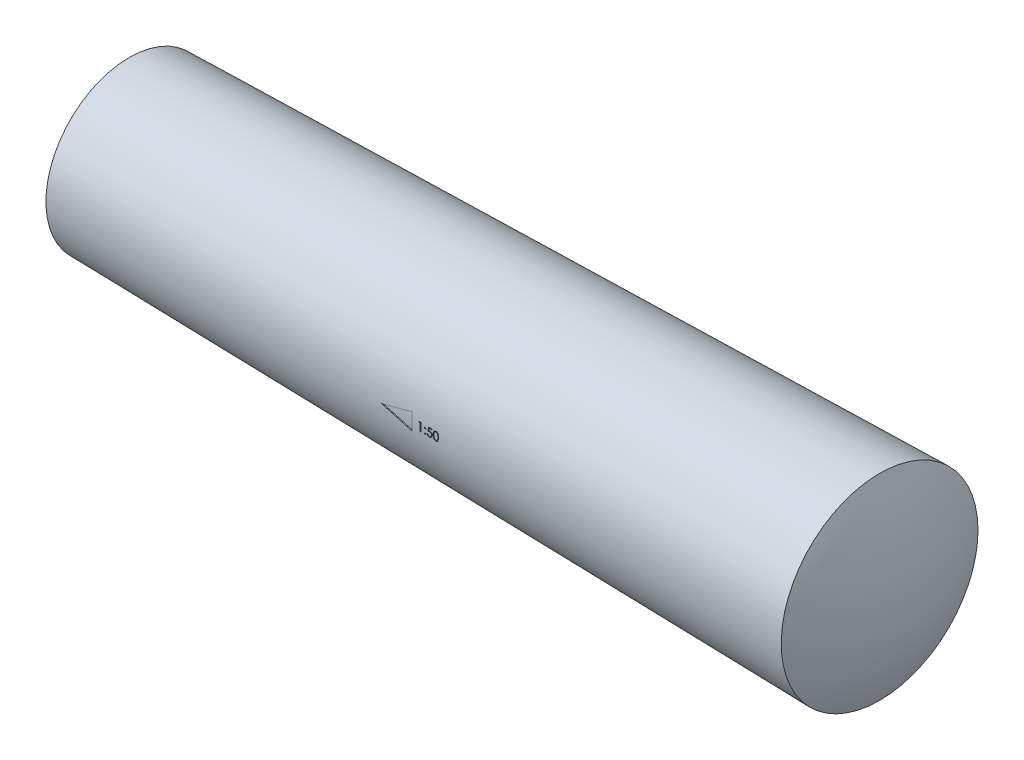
SolidWorks part; units mm, degrees
ref_plane "Front Plane" through (0, 0, 0) normal (0, 0, 1) x (1, 0, 0)
ref_plane "Top Plane" through (0, 0, 0) normal (0, 1, 0) x (1, 0, 0)
ref_plane "Right Plane" through (0, 0, 0) normal (1, 0, 0) x (0, 0, -1)
sketch "Sketch1" plane through (0, 0, 0) normal (1, 0, 0) x (0, 0, -1)
  circle A0 centre (0, 0) radius 10
  dimension "D1" = 20
extrude "Extrude1" add sketch "Sketch1" along normal mid plane 90
draft "Draft1" type of draft neutral plane draft angle 1.146 faces to draft 1 parameters "D1"=1.146
sketch "Sketch2" plane through (0, 0, 0) normal (0, 0, 1) x (1, 0, 0)
  line L0 (-45, 0) -> (-45, 10)
  line L1 (-45, 10) -> (-45, -10) construction
  line L2 (-45, 0) -> (-47.5, 0)
  line L3 (-47.5, 0) -> (-47.5, -10.9) construction
  line L4 (45, 0) -> (45, 11.8001)
  line L5 (45, -11.8001) -> (45, 11.8001) construction
  line L6 (45, 0) -> (47.5, 0)
  line L7 (47.5, 0) -> (47.5, -10.9) construction
  line L8 (-45, -10) -> (45, -11.8001) construction
  arc A0 (-47.5, 0) -> (-45, 10) centre (-26.25, 0) cw
  arc A1 (47.5, 0) -> (45, 11.8001) centre (18.4017, 0) ccw
  point P14 (0, -10.9)
revolve "Revolve1" add sketch "Sketch2" angle 360 about L2
sketch "Sketch5" plane through (0, 0, 0) normal (0, 0, 1) x (1, 0, 0)
  line L0 (0, 10.9) -> (0, -10.9) construction
  line L1 (45, 11.8001) -> (-45, 10) construction
  line L2 (-45, -10) -> (45, -11.8001) construction
ref_plane "Plane2" through (0, 0, 0) normal (-0.02, 0, 0.9998) x (0.9998, 0, 0.02)
sketch "Sketch6" plane through (0, 0, 0) normal (-0.02, 0, 0.9998) x (0.9998, 0, 0.02)
  line L0 (0, 0) -> (0, 1)
  line L1 (0, 10.9) -> (0, -10.9) construction
  line L2 (0, 1) -> (-3.7321, 0)
  line L3 (-3.7321, 0) -> (0, -1)
  line L4 (0, -1) -> (0, 0)
  line L5 (0, -0.5) -> (4, -0.5) construction
  text T0 "1:50" font "Century Gothic" height 1
  dimension "D1" = 2
  dimension "D2" = 30
  dimension "D3" = 4
wrap "Wrap2" sketch "Sketch6" wrap type deboss source sketch "Sketch6" thickness 0.1 parameters "D1"=0.1
equation "\"D2@Sketch2\" = \"D1@Sketch2\""
